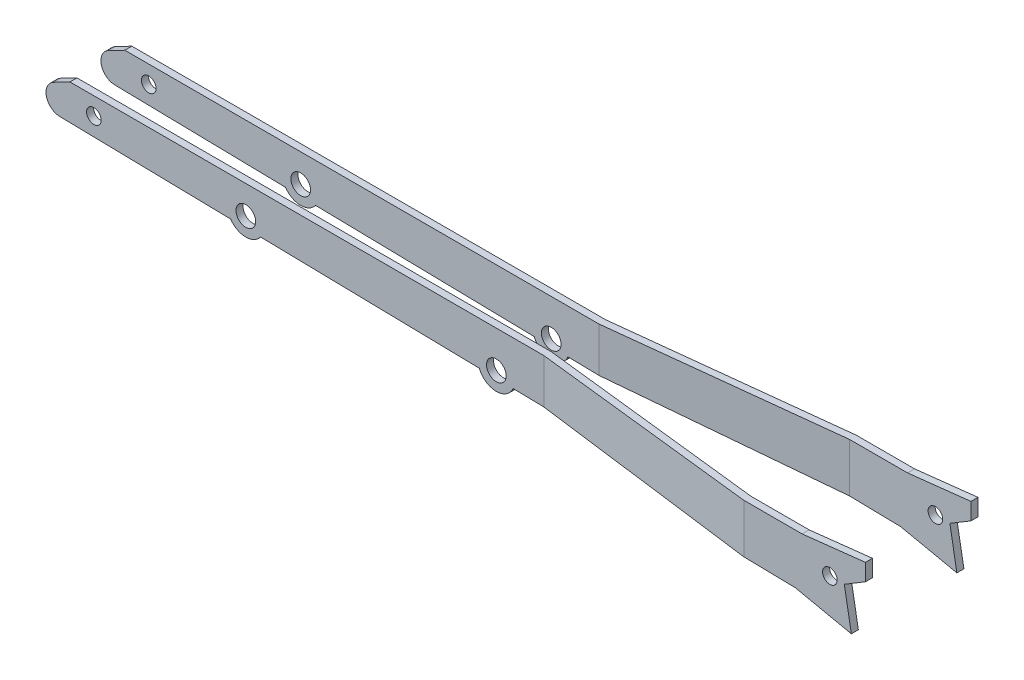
SolidWorks part; units mm, degrees
ref_plane "Front" through (0, 0, 0) normal (0, 0, 1) x (1, 0, 0)
ref_plane "Top" through (0, 0, 0) normal (0, 1, 0) x (1, 0, 0)
ref_plane "Right" through (0, 0, 0) normal (1, 0, 0) x (0, 0, -1)
sketch "Esquisse1" plane through (0, 0, 0) normal (0, 0, 1) x (1, 0, 0)
  line L0 (0, 0) -> (143, 0) construction
  line L1 (-8.5, 6.25) -> (160, 6.25)
  line L2 (0, 0) -> (0, 6.25) construction
  line L3 (143, 6.25) -> (143, -9.25) construction
  line L4 (54, 6.25) -> (54, -7.5) construction
  line L5 (-8.5, 6.25) -> (-14.3042, 3.2362)
  line L6 (59.235, -7.6029) -> (136.9518, -9.1311)
  line L7 (48.6176, -7.3942) -> (-12.0983, -6.2003)
  line L8 (54, -3.75) -> (54, -10.25) construction
  line L9 (143, -6.75) -> (143, -13.25) construction
  line L10 (48.6176, -7.3942) -> (59.235, -7.6029) construction
  line L11 (143, -9.25) -> (136.9518, -9.1311) construction
  line L12 (143, -9.25) -> (148.9499, -9.367) construction
  line L13 (148.9499, -9.367) -> (160, -9.5843)
  line L14 (160, 6.25) -> (160, -9.5843)
  circle A0 centre (0, 0) radius 2.6
  circle A1 centre (143, -6.75) radius 3.5
  circle A2 centre (54, -3.75) radius 3.5
  arc A3 (-14.3042, 3.2362) -> (-12.0983, -6.2003) centre (-12, -1.2013) ccw
  arc A4 (48.6176, -7.3942) -> (59.235, -7.6029) centre (54, -3.75) ccw
  arc A5 (136.9518, -9.1311) -> (148.9499, -9.367) centre (143, -6.75) ccw
  dimension "D2" = 5.2
  dimension "D6" = 13
  dimension "D8" = 7
  dimension "D12" = 7
  dimension "D13" = 10
  dimension "D15" = 13
  dimension "D16" = 13
  dimension "D1" = 143
  dimension "D3" = 6.25
  dimension "D4" = 160
  dimension "D5" = 15.5
  dimension "D7" = 54
  dimension "D9" = 10
  dimension "D10" = 8.5
  dimension "D11" = 13.75
  dimension "D14" = 12
extrude "Boss.-Extru.1" add sketch "Esquisse1" along normal blind 2.5
sketch "Esquisse2" plane through (0, 6.25, 0) normal (0, 1, 0) x (1, 0, 0)
  line L0 (160, 0) -> (240, -9)
  line L1 (159.8598, -2.5) -> (240, -11.5158)
  line L2 (160, -2.5) -> (-8.5, -2.5) construction
  line L3 (160, -1.25) -> (240, -10.25) construction
  line L4 (160, -2.5) -> (160, 0) construction
  line L5 (240, -9) -> (240, -11.5158) construction
  line L6 (160, 0) -> (159.8598, -2.5)
  line L7 (240, -9) -> (240, -11.5158)
  dimension "D1" = 2.5
  dimension "D2" = 80
  dimension "D3" = 9
extrude "Boss.-Extru.2" add sketch "Esquisse2" against normal blind 22
ref_plane "Plan3" through (0, 0, 11.5) normal (0, 0, -1) x (-1, 0, 0)
sketch "Esquisse10" plane through (0, 0, 11.5) normal (0, 0, -1) x (-1, 0, 0)
  line L0 (-240, 6.25) -> (-260.6313, 6.25)
  line L1 (-260.6313, 6.25) -> (-283.1313, 8.75)
  line L2 (-283.1313, 8.75) -> (-283.1313, 2.75)
  line L3 (-275.6313, -1.75) -> (-283.1313, 2.75)
  line L4 (-275.6313, -1.75) -> (-278.1313, -15.75)
  line L5 (-240, 6.25) -> (-240, -15.75)
  line L6 (-240, -15.75) -> (-278.1313, -15.75)
  line L7 (-240, -15.75) -> (-240, 6.25) construction
  line L8 (-159.8598, -15.75) -> (-240, -15.75) construction
  line L9 (-159.8598, 6.25) -> (-240, 6.25) construction
  line L10 (-275.6313, -1.75) -> (-240, -1.75) construction
  arc A0 (12.0983, -6.2003) -> (14.3042, 3.2362) centre (12, -1.2013) ccw construction
  circle A1 centre (-270.5, -1.75) radius 2.6
  circle A2 centre (-143, -6.75) radius 3.5 construction
  point P11 (16.8687, -2.3394)
  dimension "D8" = 5.2
  dimension "D9" = 127.5
  dimension "D1" = 300
  dimension "D2" = 5
  dimension "D3" = 2.5
  dimension "D4" = 22.5
  dimension "D5" = 8
  dimension "D6" = 7.5
  dimension "D7" = 6
extrude "Boss.-Extru.5" add sketch "Esquisse10" along normal blind 2.5
sketch "Esquisse11" plane through (0, 0, 11.5) normal (0, 0, 1) x (1, 0, 0)
  line L0 (159.8598, -9.5815) -> (258.1313, -11.5138)
  line L1 (258.1313, -11.5138) -> (278.1313, -15.75)
  line L2 (278.1313, -15.75) -> (159.8598, -15.75)
  line L3 (159.8598, -15.75) -> (159.8598, -9.5815)
  line L4 (59.235, -7.6029) -> (136.9518, -9.1311) construction
  dimension "D1" = 20
extrude "Enlèv. mat.-Extru.6" cut sketch "Esquisse11" against normal up to next and the other way up to next
ref_plane "Plan5" through (0, 0, -8.5) normal (0, 0, 1) x (1, 0, 0)
mirror "Symétrie2" about plane through (0, 0, -8.5) normal (0, 0, 1)
